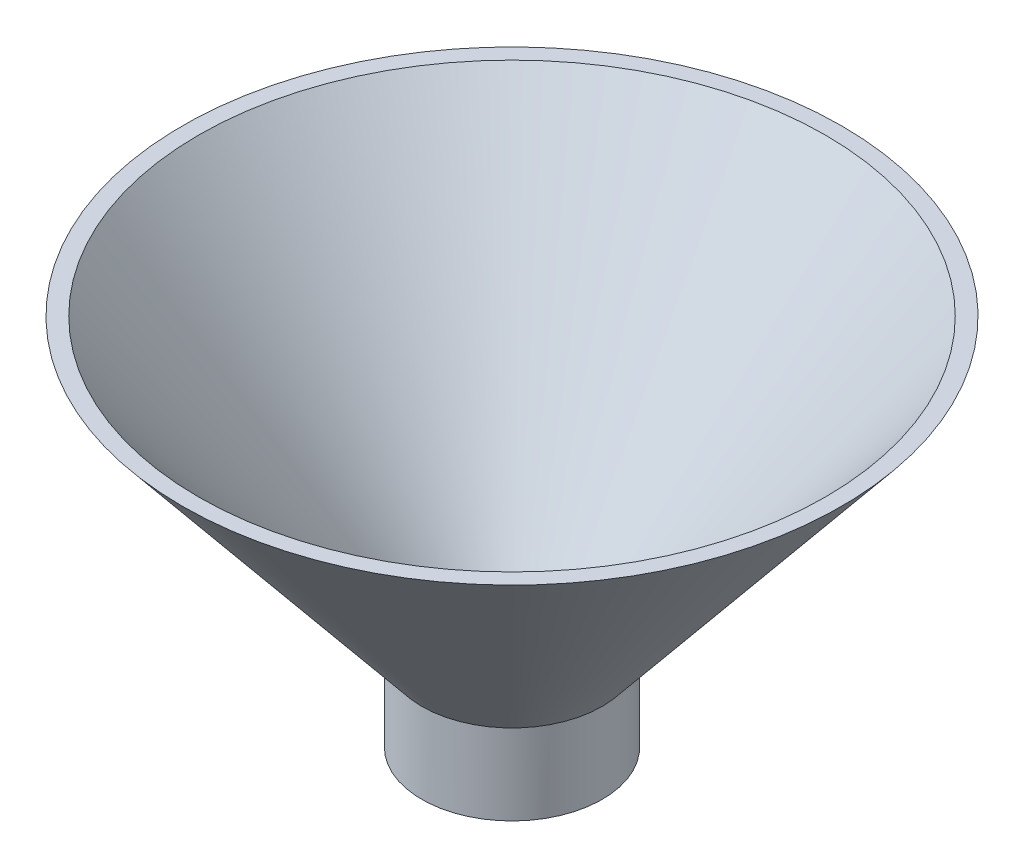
SolidWorks part; units mm, degrees
ref_plane "Front Plane" through (0, 0, 0) normal (0, 0, 1) x (1, 0, 0)
ref_plane "Top Plane" through (0, 0, 0) normal (0, 1, 0) x (1, 0, 0)
ref_plane "Right Plane" through (0, 0, 0) normal (1, 0, 0) x (0, 0, -1)
sketch "Sketch1" plane through (0, 0, 0) normal (0, 0, 1) x (1, 0, 0)
  line L0 (6.35, 11.8313) -> (6.35, 18.8163)
  line L1 (6.35, 18.8163) -> (27.178, 44.2163)
  line L2 (27.178, 44.2163) -> (28.575, 44.2163)
  line L3 (28.575, 44.2163) -> (7.8257, 18.8163)
  line L4 (7.8257, 18.8163) -> (7.8257, 11.8313)
  line L5 (7.8257, 11.8313) -> (6.35, 11.8313)
  line L6 (0, 18.252) -> (0, 44.5644) construction
  dimension "D1" = 6.985
  dimension "D2" = 6.35
  dimension "D3" = 28.575
  dimension "D4" = 27.178
  dimension "D5" = 1.4757
  dimension "D6" = 25.4
  dimension "D7" = 25.4
revolve "Revolve1" add sketch "Sketch1" angle 360 about L6
